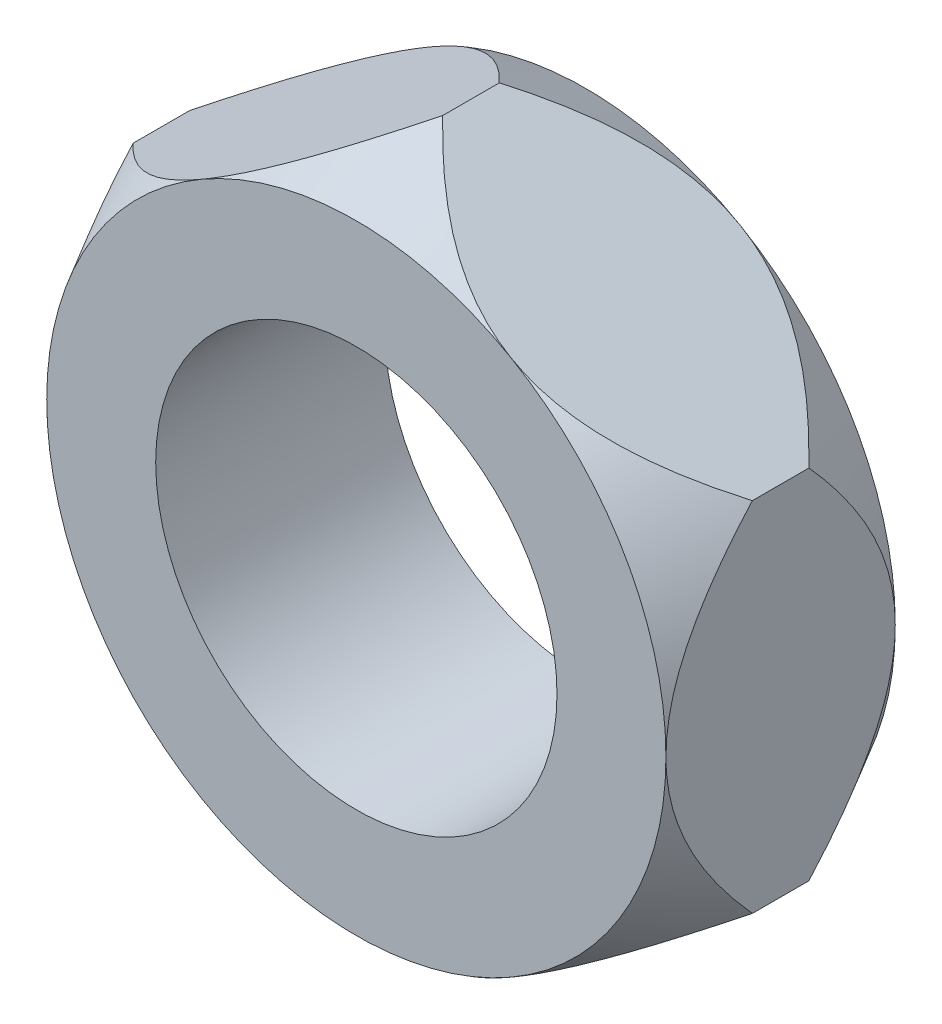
SolidWorks part; units mm, degrees
ref_plane "Front Plane" through (0, 0, 0) normal (0, 0, 1) x (1, 0, 0)
ref_plane "Top Plane" through (0, 0, 0) normal (0, 1, 0) x (1, 0, 0)
ref_plane "Right Plane" through (0, 0, 0) normal (1, 0, 0) x (0, 0, -1)
sketch "Sketch1" plane through (0, 0, 0) normal (0, 0, 1) x (1, 0, 0)
  line L1 (0, 3.1177) -> (-2.7, 1.5588)
  line L2 (-2.7, 1.5588) -> (-2.7, -1.5588)
  line L3 (-2.7, -1.5588) -> (0, -3.1177)
  line L4 (0, -3.1177) -> (2.7, -1.5588)
  line L5 (2.7, -1.5588) -> (2.7, 1.5588)
  line L6 (2.7, 1.5588) -> (0, 3.1177)
  circle A0 centre (0, 0) radius 2.7 construction
extrude "Boss-Extrude1" add sketch "Sketch1" along normal blind 2
sketch "Sketch2" plane through (0, 0, 2) normal (0, 0, 1) x (1, 0, 0)
  circle A0 centre (0, 0) radius 2.7
extrude "Cut-Extrude1" cut sketch "Sketch2" against normal through all draft 29 flip side to cut
ref_plane "Plane1" through (0, 0, 1) normal (0, 0, -1) x (-1, 0, 0)
mirror "Mirror1" about plane through (0, 0, 1) normal (0, 0, -1) of "Cut-Extrude1"
sketch "Sketch3" plane through (0, 0, 2) normal (0, 0, 1) x (1, 0, 0)
  circle A0 centre (0, 0) radius 1.75
extrude "Cut-Extrude2" cut sketch "Sketch3" against normal blind 2
